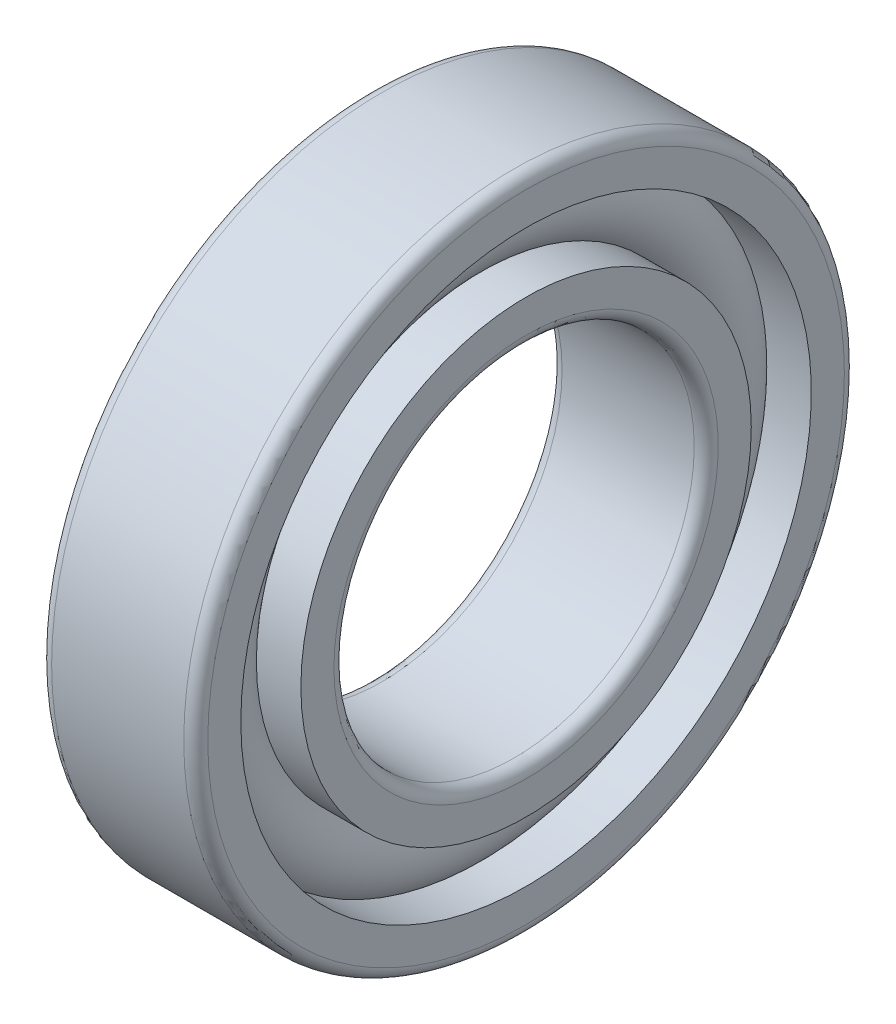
SolidWorks part; units mm, degrees
ref_plane "Plan de face" through (0, 0, 0) normal (0, 0, 1) x (1, 0, 0)
ref_plane "Plan de dessus" through (0, 0, 0) normal (0, 1, 0) x (1, 0, 0)
ref_plane "Plan de droite" through (0, 0, 0) normal (1, 0, 0) x (0, 0, -1)
imported_body "Roulement_r1rb_Bint59-1-solid1"
imported_body "Roulement_r1rb_Bext59-1-solid1"
sketch "Esquisse1" plane through (0, 0, 0) normal (0, 0, 1) x (1, 0, 0)
  line L0 (0, 0) -> (21.5996, 0) construction
  line L1 (0, 26.5) -> (0, -26.5) construction
  line L2 (0.5, 23.65) -> (0.7, 23.65)
  line L3 (0.5, 23.65) -> (0.5, 18.85)
  line L4 (0.5, 18.85) -> (0.7, 18.85)
  line L5 (0.7, 23.65) -> (0.7, 18.85)
  line L6 (3.7049, 23.75) -> (0, 23.75) construction
  line L8 (3.7049, 18.75) -> (0, 18.75) construction
  dimension "D1" = 0.2
  dimension "D2" = 0.5
  dimension "D3" = 0.1
  dimension "D4" = 0.1
revolve "JOINT" add sketch "Esquisse1" angle 360 about L0
sketch "Esquisse2" plane through (0, 0, 0) normal (0, 0, 1) x (1, 0, 0)
  line L0 (0, 0) -> (25.3706, 0) construction
  circle A0 centre (6.5, 21.25) radius 3.75 construction
  arc A2 (9.2951, 23.75) -> (3.7049, 23.75) centre (6.5, 21.25) ccw construction
  circle A3 centre (6.5, 21.25) radius 3.7
  circle A4 centre (6.5, 21.25) radius 3.75
  dimension "D1" = 0.05
  dimension "D2" = 0.05
revolve "Révolution1" add sketch "Esquisse2" angle 360 about L0
